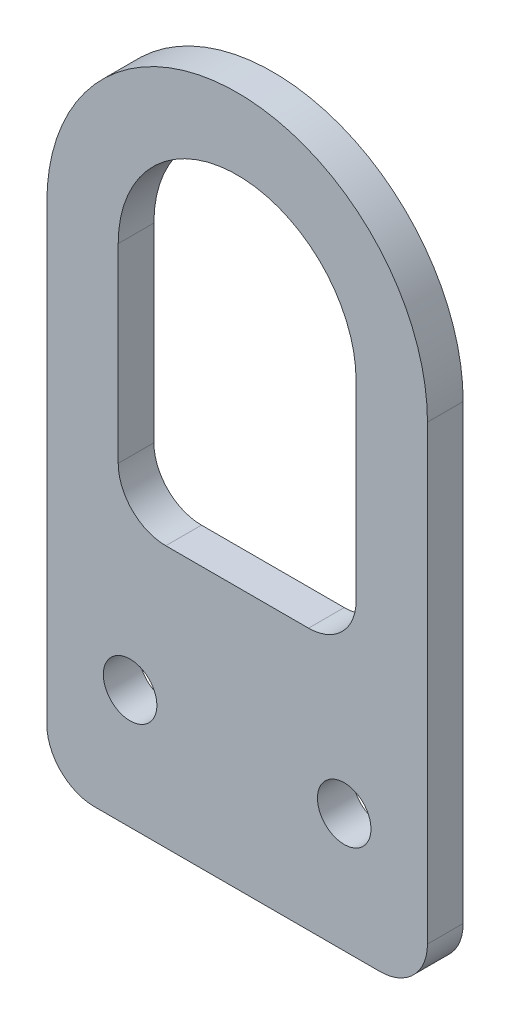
SolidWorks part; units mm, degrees
ref_plane "Front" through (0, 0, 0) normal (0, 0, 1) x (1, 0, 0)
ref_plane "Top" through (0, 0, 0) normal (0, 1, 0) x (1, 0, 0)
ref_plane "Right" through (0, 0, 0) normal (1, 0, 0) x (0, 0, -1)
sketch "Sketch1" plane through (0, 0, 0) normal (0, 0, 1) x (1, 0, 0)
  line L0 (-50.8, -103.7174) -> (50.8, -103.7174)
  line L2 (0, 0) -> (0, 37.6254) construction
  line L3 (50.8, -103.7174) -> (50.8, -139.7)
  line L4 (-50.8, -103.7174) -> (-50.8, -139.7)
  line L5 (-38.1, -152.4) -> (38.1, -152.4)
  circle A2 centre (-28.575, -120.65) radius 7.1438
  circle A3 centre (28.575, -120.65) radius 7.1438
  arc A4 (38.1, -152.4) -> (50.8, -139.7) centre (38.1, -139.7) ccw
  arc A5 (-38.1, -152.4) -> (-50.8, -139.7) centre (-38.1, -139.7) cw
  dimension "D8" = 14.2875
  dimension "D9" = 14.2875
  dimension "D14" = 12.7
  dimension "D5" = 50.8
  dimension "D6" = 50.8
extrude "Extrude1" add sketch "Sketch1" along normal blind 9.525
sketch "Sketch3" plane through (0, 0, 9.525) normal (0, 0, 1) x (1, 0, 0)
  line L0 (50.8, -103.7174) -> (50.8, 30.2056) construction
  line L1 (-50.8, -103.7174) -> (-50.8, 30.2056) construction
  line L2 (-50.8, -19.05) -> (50.8, -19.05) construction
  line L4 (-19.05, -82.55) -> (19.05, -82.55)
  line L5 (50.8, -19.05) -> (50.8, -103.7174)
  line L6 (31.75, -19.05) -> (31.75, -69.85)
  line L7 (-50.8, -103.7174) -> (50.8, -103.7174)
  line L8 (-50.8, -19.05) -> (-50.8, -103.7174)
  line L9 (-31.75, -19.05) -> (-31.75, -69.85)
  arc A0 (50.8, -19.05) -> (-50.8, -19.05) centre (0, -19.05) ccw
  arc A1 (31.75, -19.05) -> (-31.75, -19.05) centre (0, -19.05) ccw
  arc A2 (19.05, -82.55) -> (31.75, -69.85) centre (19.05, -69.85) ccw
  arc A3 (-19.05, -82.55) -> (-31.75, -69.85) centre (-19.05, -69.85) cw
  circle A5 centre (28.575, -120.65) radius 7.1438 construction
  dimension "D1" = 101.6
  dimension "D3" = 12.7
  dimension "D4" = 50.8
  dimension "D5" = 31.75
  dimension "D2" = 63.5
extrude "Extrude2" add sketch "Sketch3" against normal up to surface (9.525 mm away)
